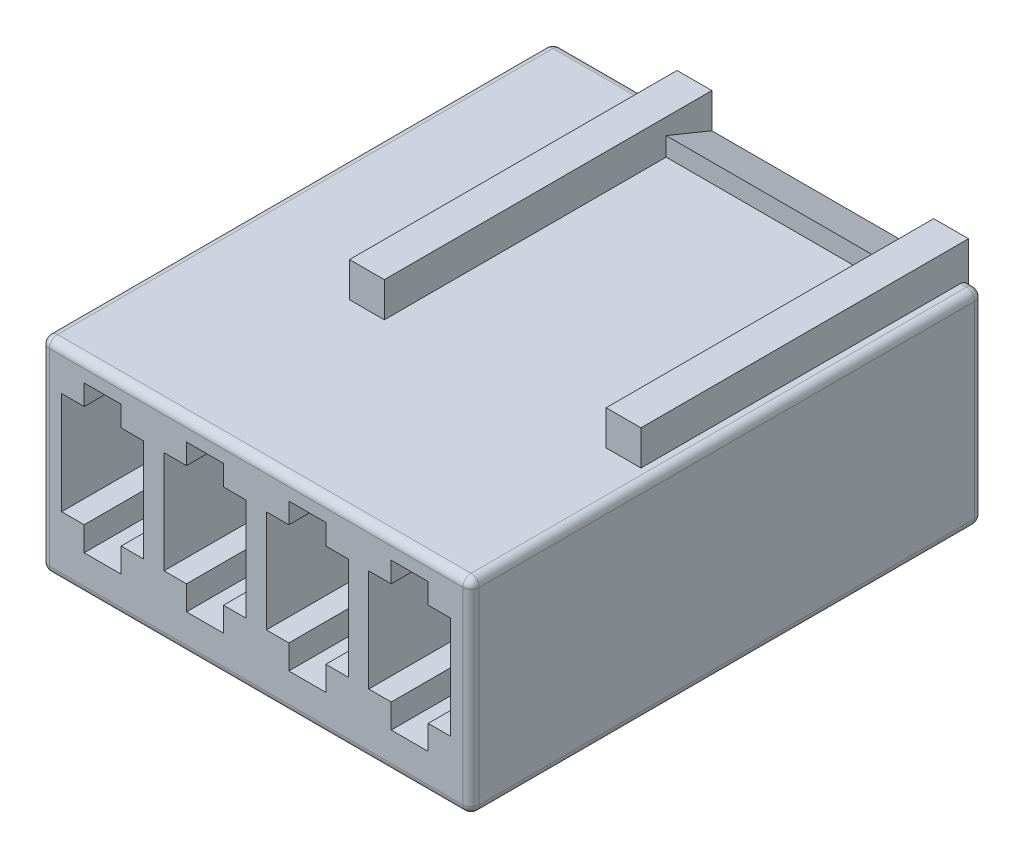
SolidWorks part; units mm, degrees
ref_plane "Front Plane" through (0, 0, 0) normal (0, 0, 1) x (1, 0, 0)
ref_plane "Top Plane" through (0, 0, 0) normal (0, 1, 0) x (1, 0, 0)
ref_plane "Right Plane" through (0, 0, 0) normal (1, 0, 0) x (0, 0, -1)
sketch "Sketch1" plane through (0, 0, 0) normal (0, 0, 1) x (1, 0, 0)
  line L1 (0, 0) -> (-10.5, 0)
  line L2 (0, 0) -> (0, 5)
  line L3 (0, 5) -> (-10.5, 5)
  line L4 (-10.5, 0) -> (-10.5, 5)
  dimension "D1" = 10.5
  dimension "D2" = 5
extrude "Boss-Extrude1" add sketch "Sketch1" along normal blind 12.5
sketch "Sketch2" plane through (0, 0, 12.5) normal (0, 0, 1) x (1, 0, 0)
  line L0 (-10, 3.5) -> (-0.3732, 3.5) construction
  line L1 (-10, 4.5) -> (-8, 4.5)
  line L2 (-10, 4.5) -> (-10, 2.5)
  line L3 (-10, 2.5) -> (-8, 2.5)
  line L4 (-8, 4.5) -> (-8, 2.5)
  line L5 (-10.5, 5) -> (-10.5, 0) construction
  line L6 (0, 5) -> (-10.5, 5) construction
  line L7 (-7.5, 4.5) -> (-7.5, 2.5)
  line L8 (-7.5, 4.5) -> (-5.5, 4.5)
  line L9 (-5.5, 4.5) -> (-5.5, 2.5)
  line L10 (-7.5, 2.5) -> (-5.5, 2.5)
  line L11 (-5, 4.5) -> (-5, 2.5)
  line L12 (-5, 4.5) -> (-3, 4.5)
  line L13 (-3, 4.5) -> (-3, 2.5)
  line L14 (-5, 2.5) -> (-3, 2.5)
  line L15 (-2.5, 4.5) -> (-2.5, 2.5)
  line L16 (-2.5, 4.5) -> (-0.5, 4.5)
  line L17 (-0.5, 4.5) -> (-0.5, 2.5)
  line L18 (-2.5, 2.5) -> (-0.5, 2.5)
  dimension "D1" = 2
  dimension "D2" = 2
  dimension "D3" = 0.5
  dimension "D4" = 0.5
  dimension "D5" = 4
extrude "Cut-Extrude1" cut sketch "Sketch2" against normal through all
sketch "Sketch3" plane through (0, 0, 0) normal (0, 0, -1) x (-1, 0, 0)
  line L0 (0, 5) -> (10.5, 5) construction
  line L1 (0.35, 5) -> (1.2, 5)
  line L2 (0.35, 5) -> (0.35, 5.85)
  line L3 (0.35, 5.85) -> (1.2, 5.85)
  line L4 (1.2, 5) -> (1.2, 5.85)
  line L5 (0, 0) -> (0, 5) construction
  line L6 (6.6186, 5) -> (7.4686, 5)
  line L7 (6.6186, 5) -> (6.6186, 5.85)
  line L8 (6.6186, 5.85) -> (7.4686, 5.85)
  line L9 (7.4686, 5) -> (7.4686, 5.85)
  point P6 (0.35, 5.425)
  dimension "D1" = 0.85
  dimension "D2" = 0.85
  dimension "D3" = 0.35
  dimension "D4" = 0.85
  dimension "D5" = 0.85
extrude "Boss-Extrude2" add sketch "Sketch3" against normal blind 8
sketch "Sketch4" plane through (0, 0, 12.5) normal (0, 0, 1) x (1, 0, 0)
  line L0 (-7.5, 4.5) -> (-7.5, 0.9065)
  line L1 (-10, 4.5) -> (-7.9967, 4.5)
  line L2 (-10, 4.5) -> (-10, 0.9065)
  line L3 (-10, 0.9065) -> (-7.9967, 0.9065)
  line L4 (-7.9967, 4.5) -> (-7.9967, 0.9065)
  line L5 (-7.5, 4.5) -> (-5.4967, 4.5)
  line L6 (-5.4967, 4.5) -> (-5.4967, 0.9065)
  line L7 (-7.5, 0.9065) -> (-5.4967, 0.9065)
  line L8 (-5, 4.5) -> (-5, 0.9065)
  line L9 (-5, 4.5) -> (-2.9967, 4.5)
  line L10 (-2.9967, 4.5) -> (-2.9967, 0.9065)
  line L11 (-5, 0.9065) -> (-2.9967, 0.9065)
  line L12 (-2.5, 4.5) -> (-2.5, 0.9065)
  line L13 (-2.5, 4.5) -> (-0.4967, 4.5)
  line L14 (-0.4967, 4.5) -> (-0.4967, 0.9065)
  line L15 (-2.5, 0.9065) -> (-0.4967, 0.9065)
  dimension "D1" = 4
extrude "Cut-Extrude2" cut sketch "Sketch4" against normal blind 2.5
sketch "Sketch5" plane through (0, 0, 12.5) normal (0, 0, 1) x (1, 0, 0)
  line L0 (-10, 4.5) -> (-10, 0.9065) construction
  line L1 (-10, 4) -> (-7.9967, 4)
  line L2 (-10, 4) -> (-10, 1.5)
  line L3 (-10, 1.5) -> (-7.9967, 1.5)
  line L4 (-7.9967, 4) -> (-7.9967, 1.5)
  line L5 (-7.9967, 0.9065) -> (-7.9967, 4.5) construction
  line L6 (-7.9967, 4.5) -> (-10, 4.5) construction
  line L7 (-9.45, 4) -> (-8.5467, 4)
  line L8 (-9.45, 4) -> (-9.45, 4.5)
  line L9 (-9.45, 4.5) -> (-8.5467, 4.5)
  line L10 (-8.5467, 4) -> (-8.5467, 4.5)
  line L11 (-10, 0.9065) -> (-7.9967, 0.9065) construction
  line L12 (-9.45, 1.5) -> (-8.5467, 1.5)
  line L13 (-9.45, 1.5) -> (-9.45, 0.9065)
  line L14 (-9.45, 0.9065) -> (-8.5467, 0.9065)
  line L15 (-8.5467, 1.5) -> (-8.5467, 0.9065)
  line L16 (-10, 2.5) -> (-10, 0.9065) construction
  line L17 (-7.9967, 0.9065) -> (-7.9967, 4.5) construction
  line L19 (-9.45, 4) -> (-10, 4)
  line L20 (-9.45, 4) -> (-9.45, 4.5)
  line L21 (-9.45, 4.5) -> (-10, 4.5)
  line L22 (-10, 4) -> (-10, 4.5)
  line L23 (-8.5467, 4.5) -> (-7.9967, 4.5)
  line L24 (-8.5467, 4.5) -> (-8.5467, 4)
  line L25 (-8.5467, 4) -> (-7.9967, 4)
  line L26 (-7.9967, 4.5) -> (-7.9967, 4)
  line L27 (-10, 1.5) -> (-9.45, 1.5)
  line L28 (-10, 1.5) -> (-10, 0.9065)
  line L29 (-10, 0.9065) -> (-9.45, 0.9065)
  line L30 (-9.45, 1.5) -> (-9.45, 0.9065)
  line L31 (-8.5467, 1.5) -> (-7.9967, 1.5)
  line L32 (-8.5467, 1.5) -> (-8.5467, 0.9065)
  line L33 (-8.5467, 0.9065) -> (-7.9967, 0.9065)
  line L34 (-7.9967, 1.5) -> (-7.9967, 0.9065)
  dimension "D1" = 2.5
  dimension "D2" = 0.5
  dimension "D3" = 0.55
  dimension "D4" = 0.55
  dimension "D5" = 0.55
  dimension "D6" = 0.55
extrude "Boss-Extrude3" add sketch "Sketch5" against normal blind 2.5 contours L1 L8 M9 M8 | L10 L1 M10 M9 | L13 L3 M8 M7 | L3 L15 M7 M10
pattern_linear "LPattern1" count 4 spacing 2.5 along (1, 0, 0) of "Boss-Extrude3"
sketch "Sketch6" plane through (-1.2, 0, 0) normal (-1, 0, 0) x (0, 0, 1)
  line L0 (0, 5) -> (1.1164, 5.4552)
  line L1 (1.1164, 5.4552) -> (1.1164, 5)
  line L2 (8, 5) -> (0, 5) construction
  line L3 (1.1164, 5) -> (0, 5)
extrude "Boss-Extrude4" add sketch "Sketch6" along normal up to next
sketch "Sketch7" plane through (0, 0, 0) normal (0, -1, 0) x (1, 0, 0)
  line L0 (-2.5, 0) -> (-2.5, 10) construction
  line L1 (-1.2, 0.3687) -> (-2.5, 0.3687)
  line L2 (-1.2, 0.3687) -> (-1.2, 3.1237)
  line L3 (-1.2, 3.1237) -> (-2.5, 3.1237)
  line L4 (-2.5, 0.3687) -> (-2.5, 3.1237)
  line L5 (-3.45, 0.3687) -> (-3.45, 3.1237)
  line L6 (-3.45, 0.3687) -> (-4.75, 0.3687)
  line L7 (-4.75, 0.3687) -> (-4.75, 3.1237)
  line L8 (-3.45, 3.1237) -> (-4.75, 3.1237)
  line L9 (-5.7, 0.3687) -> (-5.7, 3.1237)
  line L10 (-5.7, 0.3687) -> (-7, 0.3687)
  line L11 (-7, 0.3687) -> (-7, 3.1237)
  line L12 (-5.7, 3.1237) -> (-7, 3.1237)
  line L13 (-7.95, 0.3687) -> (-7.95, 3.1237)
  line L14 (-7.95, 0.3687) -> (-9.25, 0.3687)
  line L15 (-9.25, 0.3687) -> (-9.25, 3.1237)
  line L16 (-7.95, 3.1237) -> (-9.25, 3.1237)
  dimension "D1" = 4
extrude "Cut-Extrude3" cut sketch "Sketch7" against normal blind 2.5
fillet "Fillet1" radius 0.2 29 edges at (0, 2.5, 0) (0, 2.5, 12.5) (0, 5, 6.25) (-5.25, 0, 0) (-5.25, 0, 12.5) (0, 0, 6.25) (-8.6, 0, 3.1237) (-9.25, 0, 1.7462) (-8.6, 0, 0.3687) (-7.95, 0, 1.7462) (-6.35, 0, 3.1237) (-7, 0, 1.7462) (-6.35, 0, 0.3687) (-5.7, 0, 1.7462) (-4.1, 0, 3.1237) (-4.75, 0, 1.7462) (-4.1, 0, 0.3687) (-3.45, 0, 1.7462) (-2.5, 0, 1.7462) (-1.85, 0, 0.3687) (-1.2, 0, 1.7462) (-1.85, 0, 3.1237) (-10.5, 5, 6.25) (-10.5, 2.5, 0) (-10.5, 2.5, 12.5) (-10.5, 0, 6.25) (-5.25, 5, 12.5) (-0.175, 5, 0) (-8.9843, 5, 0)
